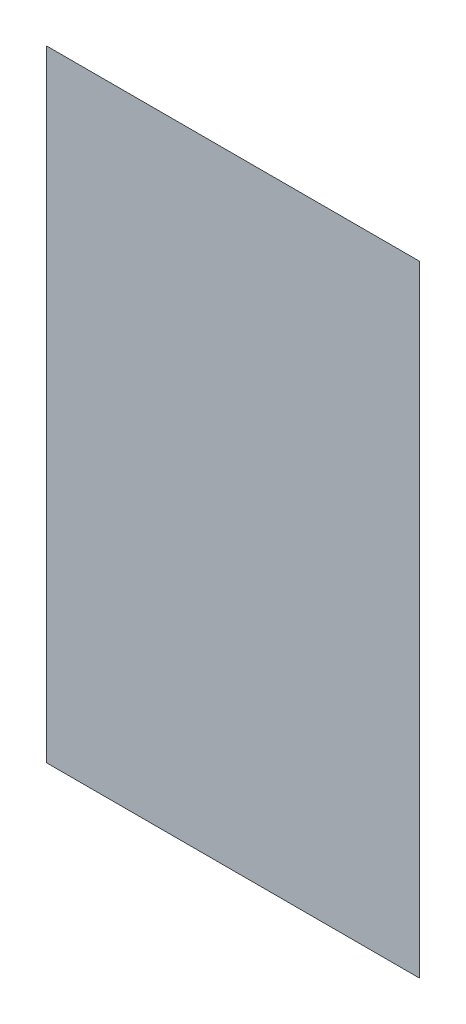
SolidWorks part; units mm, degrees
ref_plane "Front Plane" through (0, 0, 0) normal (0, 0, 1) x (1, 0, 0)
ref_plane "Top Plane" through (0, 0, 0) normal (0, 1, 0) x (1, 0, 0)
ref_plane "Right Plane" through (0, 0, 0) normal (1, 0, 0) x (0, 0, -1)
sketch "Sketch1" plane through (0, 0, 0) normal (0, 0, 1) x (1, 0, 0)
  line L1 (-150, 250) -> (0, 250)
  line L2 (-150, 250) -> (-150, 0)
  line L3 (-150, 0) -> (0, 0)
  line L4 (0, 250) -> (0, 0)
  point P0 (0, 0)
  dimension "D1" = 150
  dimension "D2" = 250
surface "Surface-Plane1" sketch "Sketch1"
